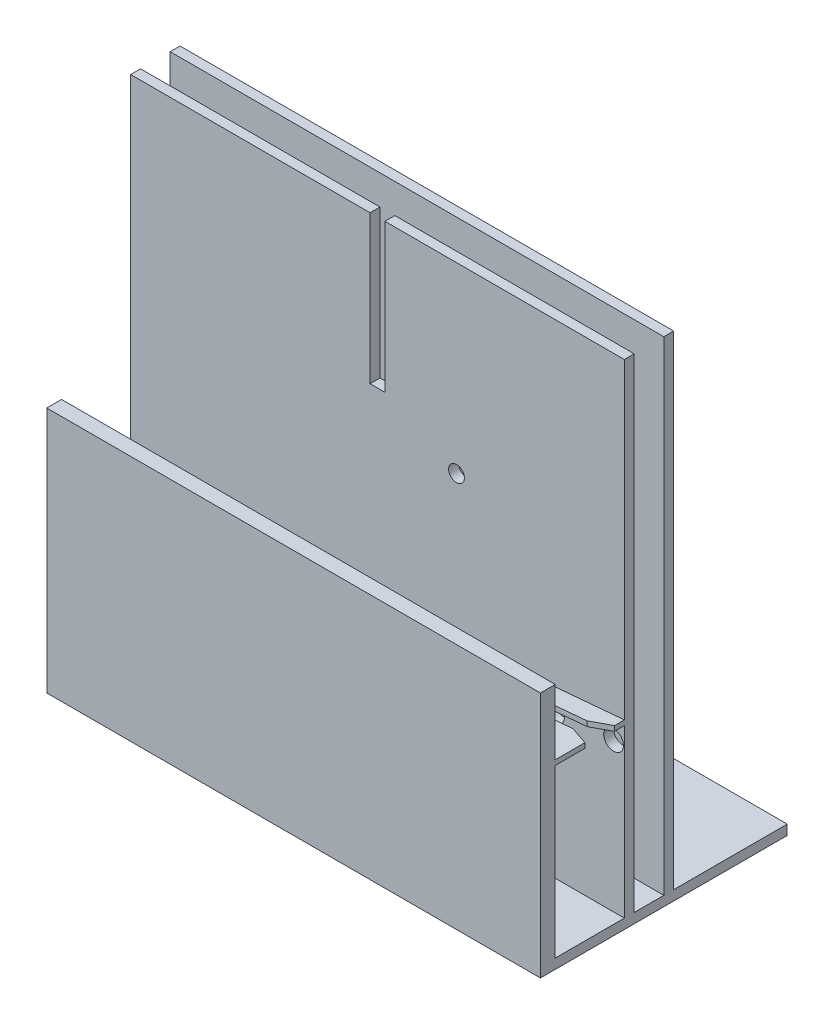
SolidWorks part; units mm, degrees
ref_plane "Front Plane" through (0, 0, 0) normal (0, 0, 1) x (1, 0, 0)
ref_plane "Top Plane" through (0, 0, 0) normal (0, 1, 0) x (1, 0, 0)
ref_plane "Right Plane" through (0, 0, 0) normal (1, 0, 0) x (0, 0, -1)
sketch "Sketch_Machine Case" plane through (0, 0, 0) normal (0, 1, 0) x (1, 0, 0)
  line L0 (-250, 125) -> (250, -125) construction
  line L1 (-250, 125) -> (250, 125)
  line L2 (-250, 125) -> (-250, -125)
  line L3 (-250, -125) -> (250, -125)
  line L4 (250, 125) -> (250, -125)
extrude "Machine Case" add sketch "Sketch_Machine Case" along normal blind 500
sketch "Sketch_Shell" plane through (0, 0, 0) normal (0, 1, 0) x (1, 0, 0)
  line L0 (-250, -125) -> (250, -125) construction
  line L1 (-250, 0) -> (250, 0)
  line L2 (-250, 0) -> (-250, -110)
  line L3 (-250, -110) -> (250, -110)
  line L4 (250, 0) -> (250, -110)
  line L5 (-250, 125) -> (-250, -125) construction
  line L6 (250, -125) -> (250, 125) construction
  line L7 (250, 125) -> (-250, 125) construction
  line L8 (-250, 125) -> (250, 125)
  line L9 (-250, 125) -> (-250, 10)
  line L10 (-250, 10) -> (250, 10)
  line L11 (250, 125) -> (250, 10)
  dimension "D1" = 15
  dimension "D2" = 10
extrude "Cut_Shell" cut sketch "Sketch_Shell" along normal through all from offset 10
sketch "Sketch_Cam Shaft" plane through (0, 0, 0) normal (0, 0, 1) x (1, 0, 0)
  line L0 (0, 0) -> (0, 315) construction
  circle A0 centre (0, 315) radius 15
  dimension "D1" = 30
  dimension "D2" = 315
extrude "Cut_Cam Shaft" cut sketch "Sketch_Cam Shaft" against normal up to next
ref_plane "Plane_Nuzzle Fixture" through (0, 0, 40) normal (0, 0, 1) x (1, 0, 0)
sketch "Sketch_Nuzzle Fixture" plane through (0, 0, 40) normal (0, 0, 1) x (1, 0, 0)
  line L4 (-250, 10) -> (250, 10)
  line L5 (250, 10) -> (250, 500)
  line L6 (250, 500) -> (-250, 500)
  line L7 (-250, 500) -> (-250, 10)
  line L8 (-250, 10) -> (250, 10)
  line L9 (250, 10) -> (250, 500)
  line L10 (250, 500) -> (-250, 500)
  line L11 (-250, 500) -> (-250, 10)
  dimension "D1" = 0
extrude "Nuzzle Fixture" add sketch "Sketch_Nuzzle Fixture" against normal blind 10
sketch "Sketch_Squeezing Slot" plane through (0, 0, 40) normal (0, 0, 1) x (1, 0, 0)
  line L0 (0, 0) -> (0, 500) construction
  line L1 (250, 500) -> (-250, 500) construction
  line L2 (-7.5, 500) -> (7.5, 500)
  line L3 (-7.5, 500) -> (-7.5, 350)
  line L4 (-7.5, 350) -> (7.5, 350)
  line L5 (7.5, 500) -> (7.5, 350)
  dimension "D1" = 15
  dimension "D2" = 150
extrude "Squeezing Slot" cut sketch "Sketch_Squeezing Slot" against normal up to next
sketch "Sketch_Case Trim" plane through (0, 0, 125) normal (0, 0, 1) x (1, 0, 0)
  line L0 (250, 500) -> (250, 0) construction
  line L1 (-250, 500) -> (250, 500)
  line L2 (-250, 500) -> (-250, 250)
  line L3 (-250, 250) -> (250, 250)
  line L4 (250, 500) -> (250, 250)
  point P8 (250, 250)
extrude "Cut_Case Trim" cut sketch "Sketch_Case Trim" against normal up to next
sketch "Sketch_Rolling Wheel Shaft Hole_Inside" plane through (0, 0, 40) normal (0, 0, 1) x (1, 0, 0)
  line L0 (0, 140) -> (0, 0) construction
  circle A0 centre (0, 140) radius 10
  dimension "D1" = 20
  dimension "D2" = 140
extrude "Cut_Rolling Wheel Shaft Hole_Inside" cut sketch "Sketch_Rolling Wheel Shaft Hole_Inside" against normal up to next
sketch "Sketch_Rolling Wheel Shaft Hole_Outside" plane through (0, 0, 110) normal (0, 0, -1) x (-1, 0, 0)
  circle A1 centre (0, 140) radius 10
  circle A2 centre (0, 140) radius 10
  dimension "D1" = 0
extrude "Cut_Rolling Wheel Shaft Hole_Outside" cut sketch "Sketch_Rolling Wheel Shaft Hole_Outside" against normal blind 10
ref_plane "Plane_Mounting Plane" through (0, 335, 0) normal (0, 1, 0) x (1, 0, 0)
sketch "Sketch_Conveyor Slant" plane through (0, 0, 110) normal (0, 0, -1) x (-1, 0, 0)
  line L0 (0, 140) -> (-250, 161.8722) construction
  line L1 (250, 125) -> (-250, 125) construction
  line L2 (250, 250) -> (250, 0) construction
  line L3 (-250, 250) -> (-250, 0) construction
  circle A0 centre (0, 140) radius 10 construction
  dimension "D1" = 5
pattern_linear "LPattern_Conveyor Slant" count 5 spacing 60 along (0.9962, 0.0872, 0) of "Cut_Rolling Wheel Shaft Hole_Outside", "Cut_Rolling Wheel Shaft Hole_Inside"
pattern_linear "LPattern_Conveyor Flat" count 5 spacing 55 along (-1, 0, 0) of "Cut_Rolling Wheel Shaft Hole_Outside", "Cut_Rolling Wheel Shaft Hole_Inside"
sketch "Sketch_Positioning Notch" plane through (0, 0, 40) normal (0, 0, 1) x (1, 0, 0)
  line L0 (250, 171.9104) -> (-0.4366, 150) construction
  line L1 (250, 10) -> (250, 500) construction
  line L2 (-0.4366, 150) -> (-250, 150) construction
  line L3 (-250, 500) -> (-250, 10) construction
  line L4 (250, 178.9104) -> (-0.4366, 157)
  line L5 (-0.4366, 157) -> (-250, 157) construction
  line L6 (250, 183.9104) -> (-0.4366, 162)
  line L7 (-0.4366, 162) -> (-250, 162) construction
  line L8 (-250, 157) -> (-250, 162) construction
  line L9 (250, 250) -> (250, 0) construction
  line L10 (-250, 250) -> (-250, 0) construction
  line L11 (250, 183.9104) -> (250, 178.9104)
  line L12 (-0.4366, 157) -> (-0.4366, 162)
  circle A0 centre (239.0867, 160.9174) radius 10 construction
  circle A2 centre (-220, 140) radius 10 construction
  circle A3 centre (0, 140) radius 10 construction
  circle A4 centre (59.7717, 145.2293) radius 10 construction
  point P28 (-250, 159.5)
  dimension "D1" = 7
  dimension "D2" = 5
extrude "Positioning Notch" add sketch "Sketch_Positioning Notch" along normal up to next
ref_plane "Plane_Notch" through (-14.0688, 160.8073, 0) normal (-0.0872, 0.9962, 0) x (0.9962, 0.0872, 0)
sketch "Sketch_Notch" plane through (-14.0688, 160.8073, 0) normal (-0.0872, 0.9962, 0) x (0.9962, 0.0872, 0)
  line L0 (265.0775, -110) -> (265.0775, -40) construction
  line L1 (13.6843, -58) -> (245.0775, -58)
  line L2 (13.6843, -58) -> (13.6843, -72)
  line L3 (13.6843, -72) -> (245.0775, -72)
  line L4 (245.0775, -58) -> (245.0775, -72) construction
  line L5 (265.0775, -65) -> (13.6843, -65) construction
  line L6 (265.0775, -40) -> (13.6843, -40) construction
  line L7 (13.6843, -110) -> (13.6843, -40) construction
  line L8 (245.0775, -72) -> (265.0775, -80)
  line L9 (265.0775, -80) -> (265.0775, -50)
  line L10 (265.0775, -50) -> (245.0775, -58)
  dimension "D1" = 20
  dimension "D2" = 25
  dimension "D3" = 30
  dimension "D4" = 14
extrude "Cut_Notch" cut sketch "Sketch_Notch" against normal up to next
ref_plane "Plane_Toothbrush Positioning" through (0, 140, 110) normal (0.9962, 0.0872, 0) x (0, 0, -1)
sketch "Sketch_Positioning Pin" plane through (0, 0, 0) normal (0, 0, 1) x (1, 0, 0)
  line L0 (0, 315) -> (0, 150) construction
  circle A0 centre (0, 150) radius 15
  circle A1 centre (0, 315) radius 15 construction
  dimension "D1" = 165
extrude "Cut_Positioning Pin" [suppressed] cut sketch "Sketch_Positioning Pin" against normal up to next
sketch "Sketch_Toothpaste Path Hold" plane through (0, 0, 0) normal (0, 0, 1) x (1, 0, 0)
  line L0 (80, 315) -> (0, 315) construction
  circle A0 centre (80, 315) radius 8
  dimension "D2" = 16
  dimension "D1" = 80
extrude "Cut_Toothpaste Path Hold" cut sketch "Sketch_Toothpaste Path Hold" against normal up to next and the other way up to surface
equation "\"D1@Machine Case\"=\"D1@Sketch_Machine Case\""
